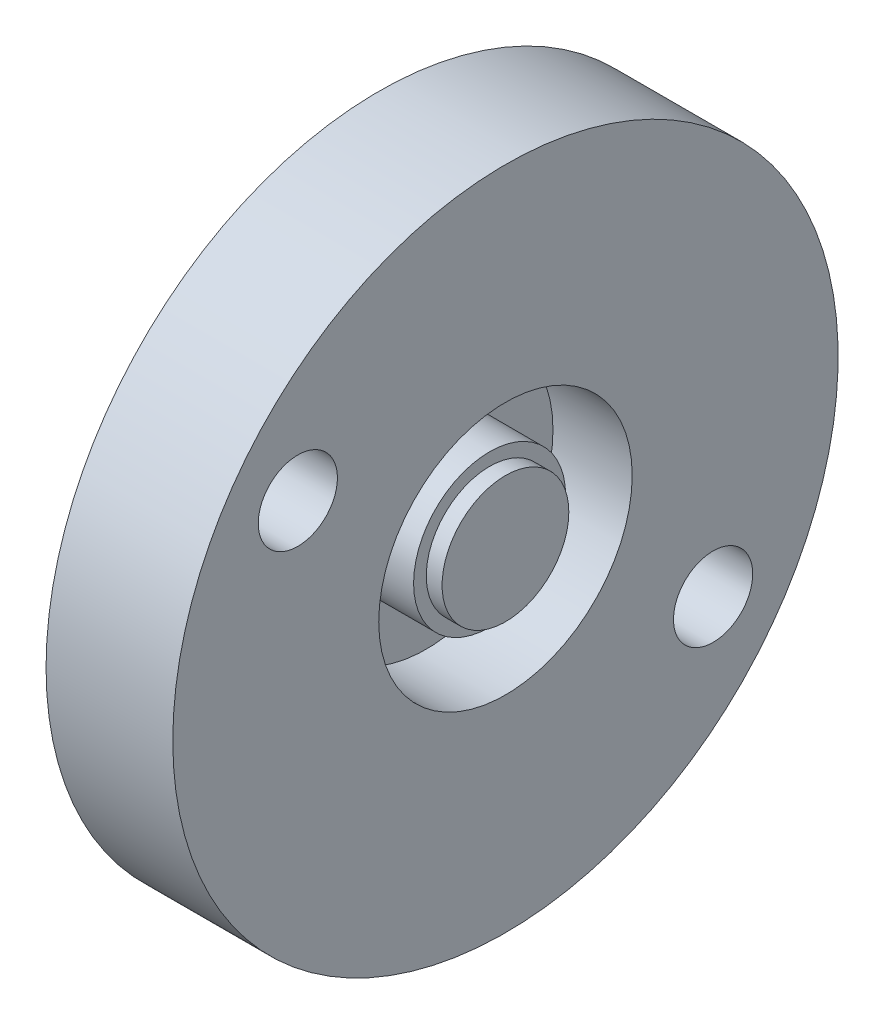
SolidWorks part; units mm, degrees
ref_plane "Front" through (0, 0, 0) normal (0, 0, 1) x (1, 0, 0)
ref_plane "Top" through (0, 0, 0) normal (0, 1, 0) x (1, 0, 0)
ref_plane "Right" through (0, 0, 0) normal (1, 0, 0) x (0, 0, -1)
ref_plane "Plane1" through (2.54, 0, 0) normal (1, 0, 0) x (0, 0, -1)
sketch "Sketch1" plane through (2.54, 0, 0) normal (1, 0, 0) x (0, 0, -1)
  circle A0 centre (0, 0) radius 13.335
extrude "Extrude1" add sketch "Sketch1" against normal blind 5.08
hole_wizard "Hole1" positions "Sketch3" profile "Sketch2" legacy
sketch "Sketch3" plane through (2.54, 0, 0) normal (1, 0, 0) x (0, 0, -1)
  point P0 (0, 0)
sketch "Sketch2" plane through (2.54, 0, 0) normal (0, 1, 0) x (0, 0, -1)
  line L0 (0, 0) -> (0, 3.175)
  line L1 (0, 3.175) -> (5.08, 3.175)
  line L2 (5.08, 3.175) -> (5.08, 0)
  line L3 (5.08, 0) -> (0, 0)
  line L4 (0, 110) -> (0, -10) construction
  dimension "Diameter" = 10.16
  dimension "Depth" = 3.175
sketch "Sketch4" plane through (-0.635, 0, 0) normal (1, 0, 0) x (0, 0, -1)
  circle A0 centre (0, 0) radius 3.048
extrude "Extrude2" add sketch "Sketch4" along normal blind 2.54
sketch "Sketch5" plane through (1.905, 0, 0) normal (1, 0, 0) x (0, 0, -1)
  circle A0 centre (0, 0) radius 2.54
extrude "Extrude3" add sketch "Sketch5" along normal blind 0.635
hole_wizard "Hole2" positions "Sketch7" profile "Sketch6" legacy
sketch "Sketch7" plane through (2.54, 0, 0) normal (1, 0, 0) x (0, 0, -1)
  point P0 (-8.3226, 5.8275)
sketch "Sketch6" plane through (2.54, 5.8275, 8.3226) normal (0, 1, 0) x (0, 0, -1)
  line L0 (0, 0) -> (0, 2.54)
  line L1 (0, 2.54) -> (1.5875, 2.54)
  line L2 (1.5875, 2.54) -> (1.5875, 0)
  line L3 (1.5875, 0) -> (0, 0)
  line L4 (0, 110) -> (0, -10) construction
  dimension "Diameter" = 3.175
  dimension "Depth" = 2.54
hole_wizard "Hole3" positions "Sketch9" profile "Sketch8" legacy
sketch "Sketch9" plane through (2.54, 0, 0) normal (1, 0, 0) x (0, 0, -1)
  point P0 (8.3226, -5.8275)
sketch "Sketch8" plane through (2.54, -5.8275, -8.3226) normal (0, 1, 0) x (0, 0, -1)
  line L0 (0, 0) -> (0, 2.54)
  line L1 (0, 2.54) -> (1.5875, 2.54)
  line L2 (1.5875, 2.54) -> (1.5875, 0)
  line L3 (1.5875, 0) -> (0, 0)
  line L4 (0, 110) -> (0, -10) construction
  dimension "Diameter" = 3.175
  dimension "Depth" = 2.54
